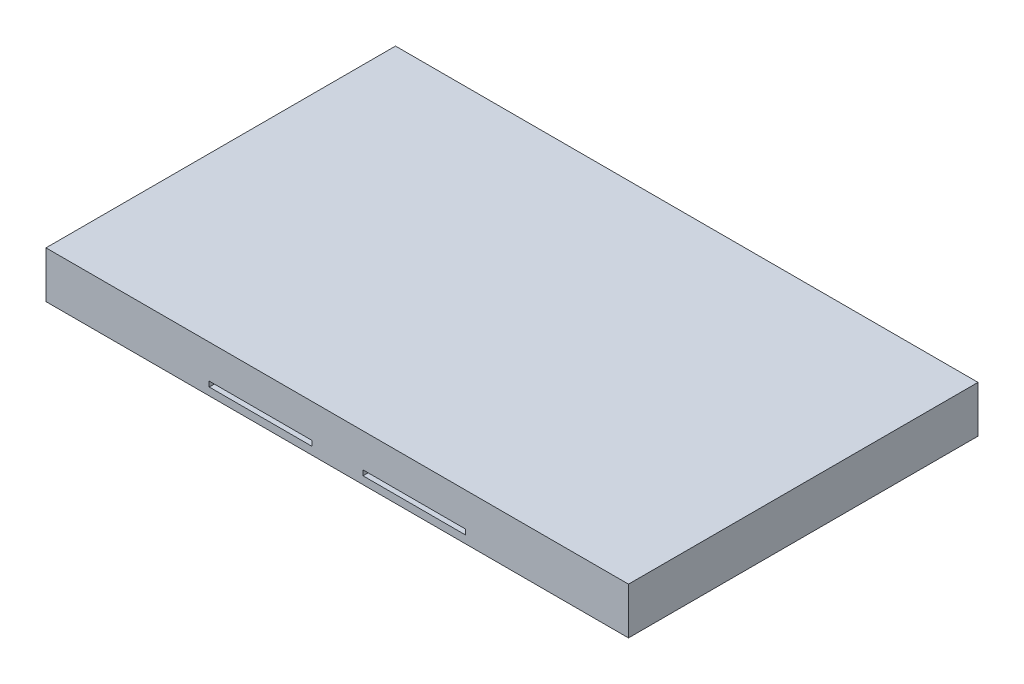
SolidWorks part; units mm, degrees
ref_plane "Front Plane" through (0, 0, 0) normal (0, 0, 1) x (1, 0, 0)
ref_plane "Top Plane" through (0, 0, 0) normal (0, 1, 0) x (1, 0, 0)
ref_plane "Right Plane" through (0, 0, 0) normal (1, 0, 0) x (0, 0, -1)
surface "Surface-Radiate1" parameters "D1"=5
surface "Surface-Knit1"
ref_plane "Plane1" through (0, 9.5461, 0) normal (0, 1, 0) x (1, 0, 0)
sketch "Sketch2" plane through (0, 9.5461, 0) normal (0, 1, 0) x (1, 0, 0)
  line L2 (60.0302, -9.7681) -> (60.0302, 9.7681)
  line L3 (-59.9698, 13.7554) -> (-59.9698, -13.7554)
  line L4 (60.0302, -9.7681) -> (60.0302, 9.7681)
  line L5 (-59.9698, 13.7554) -> (-59.9698, -13.7554)
  arc A2 (41.0303, 30.6072) -> (-45.1129, 30.2043) centre (0.0302, -412.5) ccw
  arc A3 (-45.1129, -30.2043) -> (41.0303, -30.6072) centre (0.0302, 412.5) ccw
  arc A4 (41.0303, 30.6072) -> (-45.1129, 30.2043) centre (0.0302, -412.5) ccw
  arc A5 (-45.1129, -30.2043) -> (41.0303, -30.6072) centre (0.0302, 412.5) ccw
  spline S4 degree 3 poles (2687.0574, 2926.0612) (-391.654, 211.4216) (-0.907, -84.7442) (108.5255, 35.3359) (-203.6544, 388.8117) (-2419.8072, -3112.3842) knots -7.428472 -7.428472 -7.428472 -7.428472 0.5 0.5 8.210333 8.210333 8.210333 8.210333 only from (41.0303, -30.6072) to (60.0302, -9.7681)
  spline S5 degree 3 poles (-2640.2689, 2916.9538) (-220.8345, -398.7765) (110.073, -36.9788) (0.5863, 83.0518) (-380.1485, -195.2327) (2901.9659, -2724.5411) knots -7.428472 -7.428472 -7.428472 -7.428472 0.5 0.5 8.210333 8.210333 8.210333 8.210333 only from (60.0302, 9.7681) to (41.0303, 30.6072)
  spline S6 degree 3 poles (-2727.6102, -2898.0875) (354.1721, -209.3361) (-7.8781, 77.8153) (-57.0782, 23.3206) (-58.1393, 21.5889) (-85.4886, -49.5701) (364.312, -263.3971) (1972.8591, 3416.231) knots -8.235759 -8.235759 -8.235759 -8.235759 0.5 0.5 0.75 0.75 9.874144 9.874144 9.874144 9.874144 only from (-45.1129, 30.2043) to (-59.9698, 13.7554)
  spline S7 degree 3 poles (2581.0876, -2979.476) (218.8405, 359.1694) (-103.5578, 28.1172) (-54.3354, -26.3573) (-52.7203, -27.5886) (15.2972, -62.0156) (273.6513, 363.7727) (-3223.8124, 2337.3074) knots -8.235759 -8.235759 -8.235759 -8.235759 0.5 0.5 0.75 0.75 9.874144 9.874144 9.874144 9.874144 only from (-59.9698, -13.7554) to (-45.1129, -30.2043)
  spline S8 degree 3 poles (41.0303, -30.6072) (46.2416, -30.125) (51.0737, -27.7058) (58.0712, -20.0275) (60.0302, -14.9508) (60.0302, -9.7681) knots 0 0 0 0 0.5 0.5 1 1 1 1
  spline S9 degree 3 poles (60.0302, 9.7681) (60.0302, 15.0016) (58.0666, 20.036) (51.0656, 27.7112) (46.191, 30.1297) (41.0303, 30.6072) knots 0 0 0 0 0.5 0.5 1 1 1 1
  spline S10 degree 3 poles (-45.1129, 30.2043) (-49.2047, 29.7871) (-52.9717, 27.869) (-57.0782, 23.3206) (-58.1393, 21.5889) (-59.598, 17.7935) (-59.9698, 15.7872) (-59.9698, 13.7554) knots 0 0 0 0 0.5 0.5 0.75 0.75 1 1 1 1
  spline S11 degree 3 poles (-59.9698, -13.7554) (-59.9698, -17.8684) (-58.4438, -21.8106) (-54.3354, -26.3573) (-52.7203, -27.5886) (-49.0924, -29.4249) (-47.1342, -29.9982) (-45.1129, -30.2043) knots 0 0 0 0 0.5 0.5 0.75 0.75 1 1 1 1
  dimension "D1" = 0
extrude "Boss-Extrude1" add sketch "Sketch2" against normal up to surface (10 mm away)
sketch "Sketch3" plane through (0, 9.5461, 0) normal (0, 1, 0) x (1, 0, 0)
  line L1 (-62.5, -37.5) -> (62.5, -37.5)
  line L2 (-62.5, -37.5) -> (-62.5, 37.5)
  line L3 (-62.5, 37.5) -> (62.5, 37.5)
  line L4 (62.5, -37.5) -> (62.5, 37.5)
  line L5 (-62.5, -37.5) -> (62.5, 37.5) construction
  line L6 (-62.5, 37.5) -> (62.5, -37.5) construction
  point P0 (0, 0)
  dimension "D1" = 125
  dimension "D2" = 75
extrude "Boss-Extrude2" add sketch "Sketch3" against normal up to surface (10 mm away)
sketch "Sketch5" plane through (0, 0, 37.5) normal (0, 0, 1) x (1, 0, 0)
  line L4 (5.5302, 1.1961) -> (27.5302, 1.1961)
  line L5 (27.5302, 1.1961) -> (27.5302, 2.2961)
  line L6 (27.5302, 2.2961) -> (5.5302, 2.2961)
  line L7 (5.5302, 2.2961) -> (5.5302, 1.1961)
  line L8 (5.5302, 1.1961) -> (27.5302, 1.1961)
  line L9 (27.5302, 1.1961) -> (27.5302, 2.2961)
  line L10 (27.5302, 2.2961) -> (5.5302, 2.2961)
  line L11 (5.5302, 2.2961) -> (5.5302, 1.1961)
  line L12 (-27.4698, 1.1961) -> (-5.4698, 1.1961)
  line L13 (-5.4698, 1.1961) -> (-5.4698, 2.2961)
  line L14 (-5.4698, 2.2961) -> (-27.4698, 2.2961)
  line L15 (-27.4698, 2.2961) -> (-27.4698, 1.1961)
  line L16 (-27.4698, 1.1961) -> (-5.4698, 1.1961)
  line L17 (-5.4698, 1.1961) -> (-5.4698, 2.2961)
  line L18 (-5.4698, 2.2961) -> (-27.4698, 2.2961)
  line L19 (-27.4698, 2.2961) -> (-27.4698, 1.1961)
  dimension "D1" = 0
  dimension "D2" = 0
extrude "Cut-Extrude1" cut sketch "Sketch5" against normal through all
